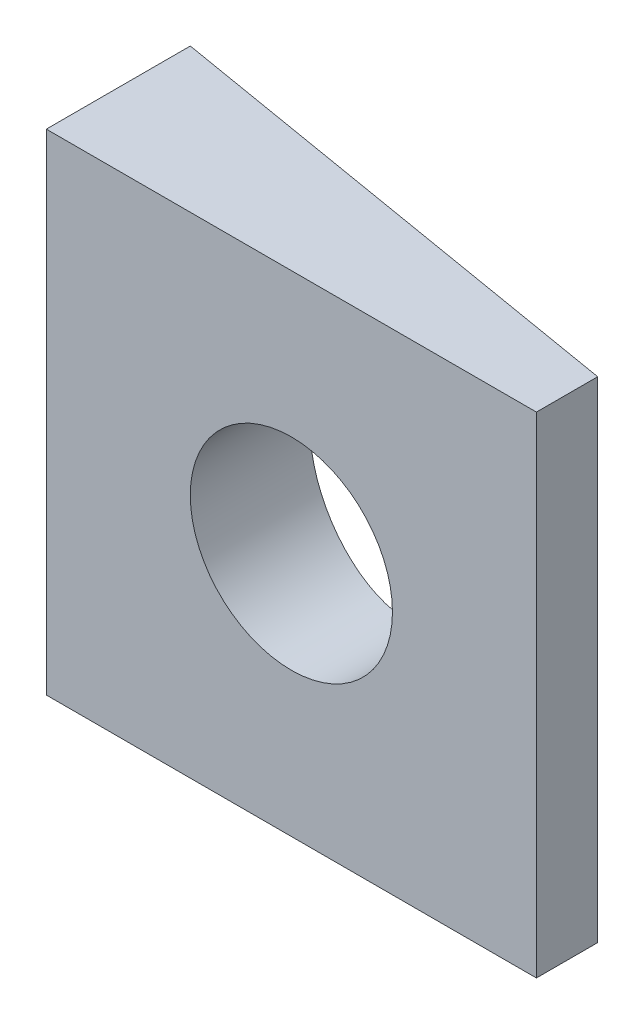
SolidWorks part; units mm, degrees
ref_plane "Front" through (0, 0, 0) normal (0, 0, 1) x (1, 0, 0)
ref_plane "Top" through (0, 0, 0) normal (0, 1, 0) x (1, 0, 0)
ref_plane "Right" through (0, 0, 0) normal (1, 0, 0) x (0, 0, -1)
other "Configuration Table"
sketch "Sketch1" plane through (0, 0, 0) normal (0, 0, 1) x (1, 0, 0)
  line L1 (8, 8) -> (-8, 8)
  line L2 (-8, 8) -> (-8, -8)
  line L3 (-8, -8) -> (8, -8)
  line L4 (8, -8) -> (8, 8)
  circle A0 centre (0, 0) radius 8 construction
  circle A1 centre (0, 0) radius 3.3
  dimension "d" = 6.6
  dimension "B" = 16
extrude "Base-Extrude" add sketch "Sketch1" against normal blind 4.7
sketch "Sketch2" plane through (0.1934, 8, -4.2576) normal (0, 1, 0) x (-1, 0, 0)
  line L0 (-7.8066, -0.4424) -> (8.1934, -0.4424)
  line L1 (8.1934, -0.4424) -> (-7.8066, 2.2576)
  line L3 (-7.8066, 2.2576) -> (-7.8066, -0.4424)
  dimension "H" = 2
extrude "Cut-Extrude1" cut sketch "Sketch2" against normal through all
